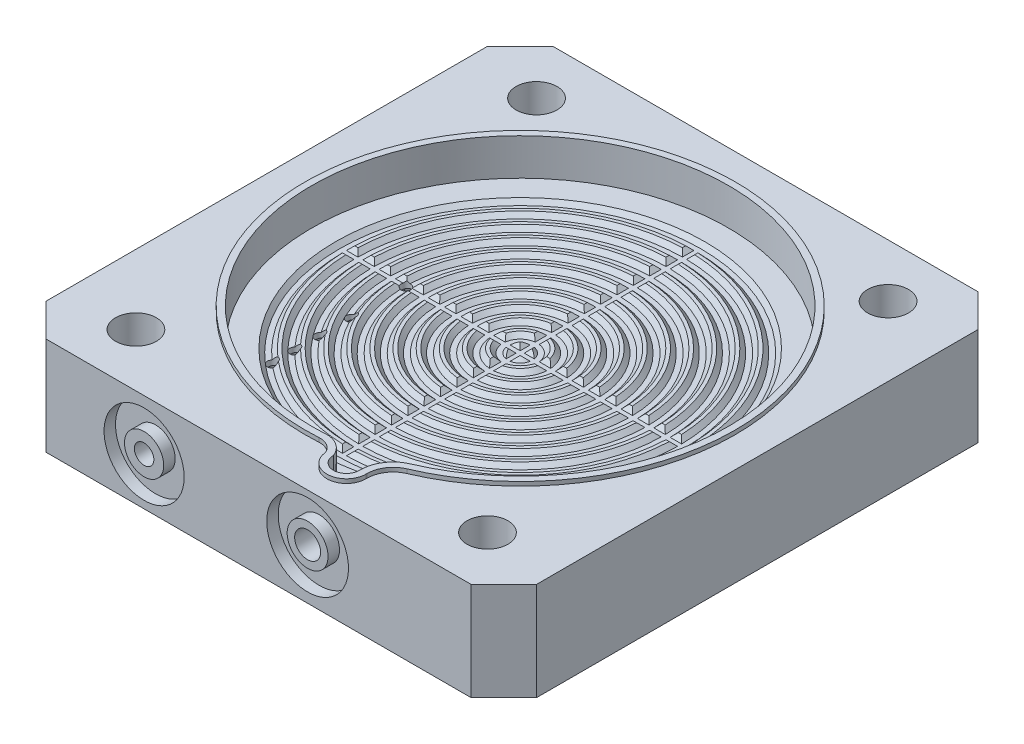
SolidWorks part; units mm, degrees
ref_plane "Front Plane" through (0, 0, 0) normal (0, 0, 1) x (1, 0, 0)
ref_plane "Top Plane" through (0, 0, 0) normal (0, 1, 0) x (1, 0, 0)
ref_plane "Right Plane" through (0, 0, 0) normal (1, 0, 0) x (0, 0, -1)
sketch "Sketch1" plane through (0, 0, 0) normal (0, 1, 0) x (1, 0, 0)
  line L0 (-3.4375, 0) -> (3.4375, 0) construction
  line L1 (0, -3.6025) -> (0, 3.6025) construction
  line L5 (15, -16) -> (-15, -16)
  line L6 (15, -16) -> (15, 15)
  line L7 (15, 15) -> (-15, 15)
  line L8 (-15, -16) -> (-15, 15)
  line L9 (15, -16) -> (-15, 15) construction
  line L10 (15, 15) -> (-15, -16) construction
  dimension "D1" = 31
  dimension "D2" = 30
  dimension "D3" = 16
  dimension "D4" = 15
extrude "Boss-Extrude1" add sketch "Sketch1" along normal blind 6
sketch "Sketch2" plane through (0, 6, 0) normal (0, 1, 0) x (1, 0, 0)
  circle A0 centre (0, 0) radius 12.75
  dimension "D1" = 25.5
extrude "Cut-Extrude1" cut sketch "Sketch2" against normal blind 2
sketch "Sketch3" plane through (0, 0, 0) normal (0, 0, 1) x (1, 0, 0)
  line L0 (0, 6.5583) -> (0, -1.4826) construction
  line L1 (1.05, 3.75) -> (1.3, 4)
  line L2 (12.75, 4) -> (-12.75, 4) construction
  line L3 (0.5, 4) -> (0.75, 3.75)
  line L4 (0.75, 3.75) -> (1.05, 3.75)
  line L5 (0, -3.6025) -> (0, 3.6025) construction
  line L6 (1.3, 4) -> (0.5, 4)
  line L7 (2.3, 4) -> (1.5, 4)
  line L8 (1.5, 4) -> (1.75, 3.75)
  line L9 (1.75, 3.75) -> (2.05, 3.75)
  line L10 (2.05, 3.75) -> (2.3, 4)
  line L11 (3.3, 4) -> (2.5, 4)
  line L12 (2.5, 4) -> (2.75, 3.75)
  line L13 (2.75, 3.75) -> (3.05, 3.75)
  line L14 (3.05, 3.75) -> (3.3, 4)
  line L15 (4.3, 4) -> (3.5, 4)
  line L16 (3.5, 4) -> (3.75, 3.75)
  line L17 (3.75, 3.75) -> (4.05, 3.75)
  line L18 (4.05, 3.75) -> (4.3, 4)
  line L19 (5.3, 4) -> (4.5, 4)
  line L20 (4.5, 4) -> (4.75, 3.75)
  line L21 (4.75, 3.75) -> (5.05, 3.75)
  line L22 (5.05, 3.75) -> (5.3, 4)
  line L23 (6.3, 4) -> (5.5, 4)
  line L24 (5.5, 4) -> (5.75, 3.75)
  line L25 (5.75, 3.75) -> (6.05, 3.75)
  line L26 (6.05, 3.75) -> (6.3, 4)
  line L27 (7.3, 4) -> (6.5, 4)
  line L28 (6.5, 4) -> (6.75, 3.75)
  line L29 (6.75, 3.75) -> (7.05, 3.75)
  line L30 (7.05, 3.75) -> (7.3, 4)
  line L31 (8.3, 4) -> (7.5, 4)
  line L32 (7.5, 4) -> (7.75, 3.75)
  line L33 (7.75, 3.75) -> (8.05, 3.75)
  line L34 (8.05, 3.75) -> (8.3, 4)
  line L35 (9.3, 4) -> (8.5, 4)
  line L36 (8.5, 4) -> (8.75, 3.75)
  line L37 (8.75, 3.75) -> (9.05, 3.75)
  line L38 (9.05, 3.75) -> (9.3, 4)
  line L39 (10.3, 4) -> (9.5, 4)
  line L40 (9.5, 4) -> (9.75, 3.75)
  line L41 (9.75, 3.75) -> (10.05, 3.75)
  line L42 (10.05, 3.75) -> (10.3, 4)
  line L43 (11.3, 4) -> (10.5, 4)
  line L44 (10.5, 4) -> (10.75, 3.75)
  line L45 (10.75, 3.75) -> (11.05, 3.75)
  line L46 (11.05, 3.75) -> (11.3, 4)
  dimension "D1" = 45
  dimension "D2" = 0.5
  dimension "D3" = 0.8
  dimension "D4" = 90
  dimension "D6" = 11
  dimension "D5" = 0.25
revolve "Cut-Revolve1" cut sketch "Sketch3" angle 360 about L0
chamfer "Chamfer1" distance 2 angle 45 4 edges at (-15, 3, 16) (-15, 3, -15) (15, 3, -15) (15, 3, 16)
hole_wizard "3/64 (0.04688) Diameter Hole1" positions "Sketch5" profile "Sketch6" hole size "3/64" standard "ANSI Inch"
sketch "Sketch5" plane through (0, 0, 16) normal (0, 0, 1) x (1, 0, 0)
  line L0 (16.5, 0) -> (-16.5, 0) construction
  line L1 (0, -3.6025) -> (0, 3.6025) construction
  point P0 (-7, 2.9)
  dimension "D1" = 2.9
  dimension "D2" = 7
sketch "Sketch6" plane through (-7, 2.9, 16) normal (1, 0, 0) x (0, -1, 0)
  line L0 (0, 0) -> (0, 16.8577)
  line L1 (0, 16.8577) -> (0.5954, 16.5)
  line L2 (0.5954, 16.5) -> (0.5954, 0)
  line L5 (0.5954, 0) -> (0, 0)
  line L10 (0, 16.8577) -> (-0.5954, 16.5) construction
  line L11 (0, -6.35) -> (0, 107.95) construction
  dimension "Hole Dia." = 1.1908
  dimension "Hole Depth" = 16.5
  dimension "Drill Angle" = 118
hole_wizard "1/16 (0.0625) Diameter Hole3" positions "Sketch8" profile "Sketch7" hole size "1/16" standard "Ansi Inch"
sketch "Sketch8" plane through (0, 0, 16) normal (0, 0, 1) x (1, 0, 0)
  line L0 (0, -3.6025) -> (0, 3.6025) construction
  line L1 (16.5, 0) -> (-16.5, 0) construction
  point P0 (3, 3.1)
  dimension "D1" = 3
  dimension "D2" = 3.1
sketch "Sketch7" plane through (3, 3.1, 16) normal (1, 0, 0) x (0, -1, 0)
  line L0 (0, 0) -> (0, 3.3769)
  line L1 (0, 3.3769) -> (0.7937, 2.9)
  line L2 (0.7937, 2.9) -> (0.7937, 0)
  line L5 (0.7937, 0) -> (0, 0)
  line L10 (0, 3.3769) -> (-0.7938, 2.9) construction
  line L11 (0, -6.35) -> (0, 107.95) construction
  dimension "Hole Dia." = 1.5875
  dimension "Hole Depth" = 2.9
  dimension "Drill Angle" = 118
sketch "Sketch9" plane through (0, 0, 16) normal (0, 0, 1) x (1, 0, 0)
  circle A0 centre (-7, 2.9) radius 1.2
  circle A1 centre (-7, 2.9) radius 2.45
  dimension "D1" = 2.4
  dimension "D2" = 4.9
extrude "Cut-Extrude2" cut sketch "Sketch9" against normal blind 0.7
sketch "Sketch11" plane through (0, 14, 16) normal (0, 0, 1) x (1, 0, 0)
  circle A0 centre (3, -10.9) radius 0.7937 construction
  circle A2 centre (3, -10.9) radius 1.25
  circle A3 centre (3, -10.9) radius 2.5
  dimension "D1" = 5
  dimension "D2" = 2.5
extrude "Cut-Extrude4" cut sketch "Sketch11" against normal blind 0.7
sketch "Sketch10" plane through (0, 4, 0) normal (0, 0, -1) x (1, 0, 0)
  line L0 (0.125, 0.25) -> (0.375, 0)
  line L1 (-15.4, 4) -> (15.4, 4) construction
  line L2 (0.375, 0) -> (-0.375, 0)
  line L3 (-0.375, 0) -> (-0.125, 0.25)
  line L5 (-0.125, 0.25) -> (0.125, 0.25)
  line L6 (0, 0.3975) -> (0, 7.6025) construction
  point P0 (0, 0.25)
  point P9 (0, 0)
  dimension "D1" = 90
  dimension "D2" = 0.75
  dimension "D3" = 4
  dimension "D4" = 0.25
extrude "Cut-Extrude3" cut sketch "Sketch10" against normal up to surface and the other way up to surface
hole_wizard "M3x0.5 Tapped Hole1" positions "Sketch24" profile "Sketch25" tap size "M3x0.5" standard "ANSI Metric"
sketch "Sketch24" plane through (0, 6, 0) normal (0, 1, 0) x (-1, 0, 0)
  line L0 (0, 3.6025) -> (0, -3.6025) construction
  line L1 (3.4375, 0) -> (-3.4375, 0) construction
  point P0 (10.75, 12.75)
  dimension "D1" = 10.75
  dimension "D2" = 12.75
sketch "Sketch25" plane through (-10.75, 6, 12.75) normal (1, 0, 0) x (0, 0, 1)
  line L0 (0, 0) -> (0, 6)
  line L1 (0, 6) -> (1.25, 6)
  line L2 (1.25, 6) -> (1.25, 0)
  line L5 (1.25, 0) -> (0, 0)
  line L11 (0, -6.35) -> (0, 107.95) construction
  dimension "Thru Tap Drill Dia." = 2.5
  dimension "Thru Tap Drill Depth" = 6
pattern_linear "LPattern1" count 2 spacing 21.5 along (1, 0, 0) count 2 spacing 24.5 along (0, 0, -1) of "M3x0.5 Tapped Hole1"
sketch "Sketch31" plane through (0, 6, 0) normal (0, 1, 0) x (1, 0, 0)
  line L0 (3, -13.625) -> (3, -10.875) construction
  line L1 (2.2063, -13.625) -> (2.2063, -10.875)
  line L2 (3.7938, -13.625) -> (3.7938, -10.875)
  line L3 (0, -3.6025) -> (0, 3.6025) construction
  line L4 (-13, -16) -> (13, -16) construction
  arc A1 (2.2063, -13.625) -> (3.7938, -13.625) centre (3, -13.625) ccw
  arc A2 (3.7938, -10.875) -> (2.2063, -10.875) centre (3, -10.875) ccw
  point P4 (3, -12.25)
  dimension "D1" = 0.7937
  dimension "D2" = 3
  dimension "D3" = 3.75
  dimension "D4" = 2.75
extrude "Cut-Extrude7" cut sketch "Sketch31" against normal blind 1
sketch "Sketch32" plane through (0, 5, 0) normal (0, 1, 0) x (1, 0, 0)
  line L0 (3, -13.625) -> (3, -13.475) construction
  line L1 (2.2063, -13.625) -> (2.2063, -13.475)
  line L2 (3.7938, -13.625) -> (3.7938, -13.475)
  arc A0 (2.2063, -13.625) -> (3.7938, -13.625) centre (3, -13.625) ccw
  arc A1 (3.7938, -13.475) -> (2.2063, -13.475) centre (3, -13.475) ccw
  point P3 (3, -13.55)
  dimension "D1" = 0.7937
  dimension "D2" = 0.15
extrude "Cut-Extrude8" cut sketch "Sketch32" against normal blind 2.2
sketch "Sketch35" plane through (0, 6, 0) normal (0, 1, 0) x (1, 0, 0)
  line L3 (3.7938, -13.625) -> (3.7938, -13.5645)
  arc A0 (5.0082, -11.7252) -> (0.8085, -12.7243) centre (0, 0) ccw
  arc A1 (3.7938, -12.1725) -> (2.2063, -12.5577) centre (0, 0) ccw construction
  arc A2 (2.2063, -13.625) -> (0.8085, -12.7243) centre (0.8973, -14.1215) ccw
  arc A3 (2.2063, -13.625) -> (3.7938, -13.625) centre (3, -13.625) ccw
  arc A4 (3.7938, -13.5645) -> (5.0082, -11.7252) centre (5.7938, -13.5645) cw
  dimension "D1" = 2
  dimension "D2" = 0.7938
  dimension "D3" = 1.4
extrude "Extrude-Thin1" add sketch "Sketch35" along normal blind 0.25 thin
sketch "Sketch36" plane through (0, 6, 0) normal (0, 1, 0) x (1, 0, 0)
  line L0 (2.2063, -13.625) -> (2.2063, -12.5577) construction
  line L1 (3.7938, -12.1725) -> (3.7938, -13.5645) construction
  line L2 (2.2063, -13.625) -> (2.2063, -12.5577)
  line L3 (3.7938, -12.1725) -> (3.7938, -13.5645)
  arc A0 (0.8085, -12.7243) -> (2.2063, -12.5577) centre (0, 0) ccw construction
  arc A1 (2.2063, -13.625) -> (0.8085, -12.7243) centre (0.8973, -14.1215) ccw construction
  arc A2 (5.0082, -11.7252) -> (3.7938, -13.5645) centre (5.7938, -13.5645) ccw construction
  arc A3 (3.7938, -12.1725) -> (5.0082, -11.7252) centre (0, 0) ccw construction
  arc A4 (0.8085, -12.7243) -> (2.2063, -12.5577) centre (0, 0) ccw
  arc A5 (2.2063, -13.625) -> (0.8085, -12.7243) centre (0.8973, -14.1215) ccw
  arc A6 (5.0082, -11.7252) -> (3.7938, -13.5645) centre (5.7938, -13.5645) ccw
  arc A7 (3.7938, -12.1725) -> (5.0082, -11.7252) centre (0, 0) ccw
extrude "Cut-Extrude9" cut sketch "Sketch36" against normal up to surface (1 mm away)
hole_wizard "#73 (0.024) Diameter Hole1" positions "Sketch63" profile "Sketch62" hole size "#73" standard "ANSI Inch"
sketch "Sketch63" plane through (0, 4, 0) normal (0, 1, 0) x (-1, 0, 0)
  line L0 (0, 3.6025) -> (0, -3.6025) construction
  line L1 (3.4375, 0) -> (-3.4375, 0) construction
  point P1 (7, 0)
  point P50 (7, 3.326)
  point P52 (7, 5.25)
  point P54 (7, 6.7869)
  point P56 (7, 8.1586)
  dimension "D1" = 7
  dimension "D2" = 3.326
  dimension "D3" = 5.25
  dimension "D4" = 6.7869
  dimension "D5" = 8.1586
sketch "Sketch62" plane through (-7, 4, 0) normal (1, 0, 0) x (0, 0, 1)
  line L0 (0, 0) -> (0, 0.5046)
  line L1 (0, 0.5046) -> (0.3048, 0.5046)
  line L2 (0.3048, 0.5046) -> (0.3048, 0)
  line L5 (0.3048, 0) -> (0, 0)
  line L11 (0, -6.35) -> (0, 107.95) construction
  dimension "Thru Hole Dia." = 0.6096
  dimension "Thru Hole Depth" = 0.5046
sketch "Sketch43" plane through (0, 0, 0) normal (0, -1, 0) x (1, 0, 0)
  line L8 (13, 16) -> (-13, 16)
  line L9 (-13, 16) -> (-15, 14)
  line L10 (-15, 14) -> (-15, -13)
  line L11 (-15, -13) -> (-13, -15)
  line L12 (-13, -15) -> (13, -15)
  line L13 (13, -15) -> (15, -13)
  line L14 (15, -13) -> (15, 14)
  line L15 (15, 14) -> (13, 16)
  line L16 (13, 16) -> (-13, 16)
  line L17 (-13, 16) -> (-15, 14)
  line L18 (-15, 14) -> (-15, -13)
  line L19 (-15, -13) -> (-13, -15)
  line L20 (-13, -15) -> (13, -15)
  line L21 (13, -15) -> (15, -13)
  line L22 (15, -13) -> (15, 14)
  line L23 (15, 14) -> (13, 16)
  dimension "D1" = 0
sketch "Sketch44" plane through (0, 0, 0) normal (0, -1, 0) x (1, 0, 0)
  circle A0 centre (-10.75, -11.75) radius 1.25 construction
  circle A1 centre (-10.75, 12.75) radius 1.25 construction
  circle A2 centre (10.75, 12.75) radius 1.25 construction
  circle A3 centre (10.75, -11.75) radius 1.25 construction
  circle A4 centre (-10.75, -11.75) radius 1.25
  circle A5 centre (-10.75, 12.75) radius 1.25
  circle A6 centre (10.75, 12.75) radius 1.25
  circle A7 centre (10.75, -11.75) radius 1.25
sketch "Sketch45" plane through (0, 0, 0) normal (0, -1, 0) x (1, 0, 0)
  line L0 (15, -13) -> (15, 14) construction
  line L1 (13, 16) -> (-13, 16) construction
  point P4 (15, 16)
sketch "Sketch46" plane through (0, 6, 0) normal (0, 1, 0) x (1, 0, 0)
  line L8 (-15, 13) -> (-15, -14)
  line L9 (-15, -14) -> (-13, -16)
  line L10 (-13, -16) -> (13, -16)
  line L11 (13, -16) -> (15, -14)
  line L12 (15, -14) -> (15, 13)
  line L13 (15, 13) -> (13, 15)
  line L14 (13, 15) -> (-13, 15)
  line L15 (-13, 15) -> (-15, 13)
  line L16 (-15, 13) -> (-15, -14)
  line L17 (-15, -14) -> (-13, -16)
  line L18 (-13, -16) -> (13, -16)
  line L19 (13, -16) -> (15, -14)
  line L20 (15, -14) -> (15, 13)
  line L21 (15, 13) -> (13, 15)
  line L22 (13, 15) -> (-13, 15)
  line L23 (-13, 15) -> (-15, 13)
  dimension "D1" = 0
sketch "Sketch47" plane through (0, 6.25, 0) normal (0, 1, 0) x (1, 0, 0)
  line L4 (4.1938, -13.625) -> (4.1938, -13.5645)
  line L5 (4.1938, -13.625) -> (4.1938, -13.5645)
  arc A4 (5.1653, -12.0931) -> (4.1938, -13.5645) centre (5.7938, -13.5645) ccw
  arc A5 (5.1653, -12.0931) -> (0.8338, -13.1235) centre (0, 0) ccw
  arc A6 (1.8094, -13.7117) -> (0.8338, -13.1235) centre (0.8973, -14.1215) ccw
  arc A7 (1.8094, -13.7117) -> (4.1938, -13.625) centre (3, -13.625) ccw
  arc A8 (5.1653, -12.0931) -> (4.1938, -13.5645) centre (5.7938, -13.5645) ccw
  arc A9 (5.1653, -12.0931) -> (0.8338, -13.1235) centre (0, 0) ccw
  arc A10 (1.8094, -13.7117) -> (0.8338, -13.1235) centre (0.8973, -14.1215) ccw
  arc A11 (1.8094, -13.7117) -> (4.1938, -13.625) centre (3, -13.625) ccw
  dimension "D1" = 0
sketch "Sketch48" plane through (0, 6.25, 0) normal (0, 1, 0) x (1, 0, 0)
  circle A0 centre (0, 0) radius 12.75 construction
  circle A1 centre (0, 0) radius 12.75
sketch "Sketch49" plane through (0, 6, 0) normal (0, 1, 0) x (1, 0, 0)
  circle A0 centre (10.75, 11.75) radius 1.25 construction
  circle A1 centre (10.75, -12.75) radius 1.25 construction
  circle A2 centre (-10.75, -12.75) radius 1.25 construction
  circle A3 centre (-10.75, 11.75) radius 1.25 construction
  circle A4 centre (10.75, 11.75) radius 1.25
  circle A5 centre (10.75, -12.75) radius 1.25
  circle A6 centre (-10.75, -12.75) radius 1.25
  circle A7 centre (-10.75, 11.75) radius 1.25
sketch "Sketch50" [suppressed] plane through (0, 6.5, 0) normal (0, 1, 0) x (1, 0, 0)
  line L0 (3.7938, -14.625) -> (3.7938, -13.5645) construction
  line L1 (2.2063, -14.1154) -> (2.2063, -14.625) construction
  line L2 (3.7938, -14.625) -> (3.7938, -13.5645)
  line L3 (2.2063, -14.1154) -> (2.2063, -14.625)
  arc A0 (5.0082, -11.7252) -> (3.7938, -13.5645) centre (5.7938, -13.5645) ccw construction
  arc A1 (2.2063, -14.625) -> (3.7938, -14.625) centre (3, -14.625) ccw construction
  arc A2 (2.2063, -14.1154) -> (0.7265, -12.7293) centre (0.8063, -14.127) ccw construction
  arc A3 (5.0082, -11.7252) -> (3.7938, -13.5645) centre (5.7938, -13.5645) ccw
  arc A4 (2.2063, -14.625) -> (3.7938, -14.625) centre (3, -14.625) ccw
  arc A5 (2.2063, -14.1154) -> (0.7265, -12.7293) centre (0.8063, -14.127) ccw
sketch "Sketch51" [suppressed] plane through (0, 4.4, 0) normal (0, 1, 0) x (1, 0, 0)
  arc A0 (0, -10.75) -> (0, 10.75) centre (0, 0) ccw construction
  arc A1 (0, -9.75) -> (0, 9.75) centre (0, 0) ccw construction
  arc A2 (0, -8.75) -> (0, 8.75) centre (0, 0) ccw construction
  arc A3 (0, -7.75) -> (0, 7.75) centre (0, 0) ccw construction
  circle A4 centre (0, 0) radius 6.75 construction
  circle A5 centre (0, 0) radius 5.75 construction
  circle A6 centre (0, 0) radius 4.75 construction
  circle A7 centre (0, 0) radius 3.75 construction
  circle A8 centre (0, 0) radius 2.75 construction
  arc A9 (0, -1.75) -> (0, 1.75) centre (0, 0) ccw construction
  circle A10 centre (0, 0) radius 0.75 construction
  circle A11 centre (0, 0) radius 10.75
  circle A12 centre (0, 0) radius 9.75
  circle A13 centre (0, 0) radius 8.75
  circle A14 centre (0, 0) radius 7.75
  circle A15 centre (0, 0) radius 6.75
  circle A16 centre (0, 0) radius 5.75
  circle A17 centre (0, 0) radius 4.75
  circle A18 centre (0, 0) radius 3.75
  circle A19 centre (0, 0) radius 2.75
  circle A20 centre (0, 0) radius 1.75
  circle A21 centre (0, 0) radius 0.75
sketch "Sketch52" [suppressed] plane through (0, 4.4, 0) normal (0, 1, 0) x (1, 0, 0)
  line L0 (0, 10.75) -> (0, -10.75) construction
  line L1 (0, 10.75) -> (0, -10.75)
  circle A1 centre (0, 0) radius 10.75 construction
sketch "Sketch53" plane through (0, 6.25, 0) normal (0, 1, 0) x (1, 0, 0)
  line L2 (13, 15) -> (-13, 15) construction
  line L3 (15, -14) -> (15, 13) construction
  point P4 (15, 15)
sketch "Sketch54" plane through (0, 6.25, 0) normal (0, 1, 0) x (1, 0, 0)
  line L0 (3.7938, -13.475) -> (3.7938, -13.625)
  line L1 (2.2063, -13.475) -> (2.2063, -13.625)
  arc A0 (3.7938, -13.475) -> (2.2063, -13.475) centre (3, -13.475) ccw construction
  arc A1 (2.2063, -13.625) -> (3.7938, -13.625) centre (3, -13.625) ccw construction
  arc A2 (3.7938, -13.475) -> (2.2063, -13.475) centre (3, -13.475) ccw
  arc A3 (2.2063, -13.625) -> (3.7938, -13.625) centre (3, -13.625) ccw
sketch "Sketch55" [suppressed] plane through (0, 6.5, 0) normal (0, 1, 0) x (1, 0, 0)
  line L0 (3.7938, -13.625) -> (3.7938, -13.5645) construction
  line L1 (2.2063, -13.625) -> (2.2063, -13.625) construction
  line L6 (3.7938, -13.625) -> (3.7938, -13.5645)
  line L7 (2.2063, -13.625) -> (2.2063, -13.625)
  line L8 (4.1938, -13.625) -> (4.1938, -13.5645)
  line L9 (4.1938, -13.625) -> (4.1938, -13.5645)
  arc A0 (5.0082, -11.7252) -> (0.8085, -12.7243) centre (0, 0) ccw construction
  arc A1 (5.0082, -11.7252) -> (3.7938, -13.5645) centre (5.7938, -13.5645) ccw construction
  arc A2 (2.2063, -13.625) -> (3.7938, -13.625) centre (3, -13.625) ccw construction
  arc A3 (2.2063, -13.625) -> (0.8085, -12.7243) centre (0.8973, -14.1215) ccw construction
  arc A4 (5.1653, -12.0931) -> (4.1938, -13.5645) centre (5.7938, -13.5645) ccw
  arc A5 (5.1653, -12.0931) -> (0.8338, -13.1235) centre (0, 0) ccw
  arc A6 (1.8094, -13.7117) -> (0.8338, -13.1235) centre (0.8973, -14.1215) ccw
  arc A7 (1.8094, -13.7117) -> (4.1938, -13.625) centre (3, -13.625) ccw
  arc A8 (5.1653, -12.0931) -> (4.1938, -13.5645) centre (5.7938, -13.5645) ccw
  arc A9 (5.1653, -12.0931) -> (0.8338, -13.1235) centre (0, 0) ccw
  arc A10 (1.8094, -13.7117) -> (0.8338, -13.1235) centre (0.8973, -14.1215) ccw
  arc A11 (1.8094, -13.7117) -> (4.1938, -13.625) centre (3, -13.625) ccw
  arc A12 (5.0082, -11.7252) -> (0.8085, -12.7243) centre (0, 0) ccw
  arc A13 (5.0082, -11.7252) -> (3.7938, -13.5645) centre (5.7938, -13.5645) ccw
  arc A14 (2.2063, -13.625) -> (3.7938, -13.625) centre (3, -13.625) ccw
  arc A15 (2.2063, -13.625) -> (0.8085, -12.7243) centre (0.8973, -14.1215) ccw
  dimension "D1" = 0
sketch "Sketch58" plane through (0, 0, 16) normal (0, 0, 1) x (1, 0, 0)
  circle A0 centre (3, 3.1) radius 2.5 construction
  circle A1 centre (3, 3.1) radius 1.25 construction
  circle A2 centre (-7, 2.9) radius 2.45 construction
  circle A3 centre (-7, 2.9) radius 1.2 construction
  circle A4 centre (3, 3.1) radius 2.5
  circle A5 centre (3, 3.1) radius 1.25
  circle A6 centre (-7, 2.9) radius 2.45
  circle A7 centre (-7, 2.9) radius 1.2
sketch "Sketch59" plane through (0, 0, 16) normal (0, 0, 1) x (1, 0, 0)
  circle A0 centre (3, 3.1) radius 0.7937 construction
  circle A1 centre (-7, 2.9) radius 0.5954 construction
  circle A2 centre (3, 3.1) radius 0.7938
  circle A3 centre (-7, 2.9) radius 0.5954
sketch "Sketch61" plane through (15, 0, 0) normal (1, 0, 0) x (0, 0, -1)
  line L0 (15, 6) -> (15, 0) construction
  line L1 (15, 0) -> (13, 0) construction
  line L2 (15, 6) -> (15, 0)
  line L3 (15, 0) -> (13, 0)
sketch "Sketch64" plane through (0, -18, 0) normal (1, 0, 0) x (0, 0, -1)
  line L0 (-0.125, 21.75) -> (-0.375, 22)
  line L1 (-0.125, 21.75) -> (0.125, 21.75)
  line L2 (-0.375, 22) -> (0.375, 22)
  line L3 (0.375, 22) -> (0.125, 21.75)
  line L4 (0, 21.4375) -> (0, 14.5625) construction
  line L5 (0.3307, 22) -> (-0.3307, 22) construction
  point P5 (0, 22)
  point P9 (0, 21.75)
  dimension "D1" = 90
  dimension "D2" = 0.75
  dimension "D3" = 0.25
extrude "Cut-Extrude10" cut sketch "Sketch64" against normal up to surface and the other way up to surface
pattern_linear "LPattern3" [suppressed] count 3 spacing 3.75
sketch "Sketch65" plane through (0, 0, 16) normal (0, 0, 1) x (1, 0, 0)
  circle A0 centre (-7, 2.9) radius 0.5954
extrude "Fill in outlet port" [suppressed] add sketch "Sketch65" against normal blind 10
sketch "Sketch39" plane through (0, 4, 0) normal (0, 1, 0) x (1, 0, 0)
  circle A0 centre (0, 0) radius 12.7
extrude "Fill in Channels" [suppressed] add sketch "Sketch39" against normal blind 1.6943
